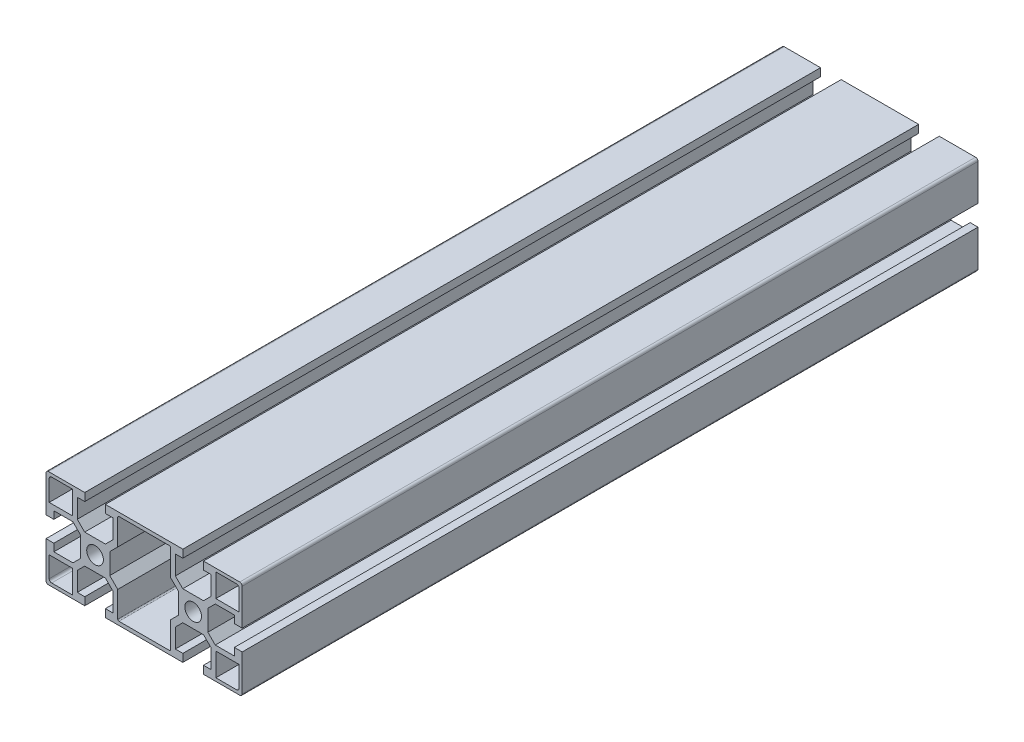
SolidWorks part; units mm, degrees
ref_plane "前视基准面" through (0, 0, 0) normal (0, 0, 1) x (1, 0, 0)
ref_plane "上视基准面" through (0, 0, 0) normal (0, 1, 0) x (1, 0, 0)
ref_plane "右视基准面" through (0, 0, 0) normal (1, 0, 0) x (0, 0, -1)
sketch "草图1"
sketch_block_instance "A$C1E6A52AC-1"
sketch_block "A$C1E6A52AC"
extrude "凸台-拉伸1" add sketch "草图1" along normal mid plane 300
